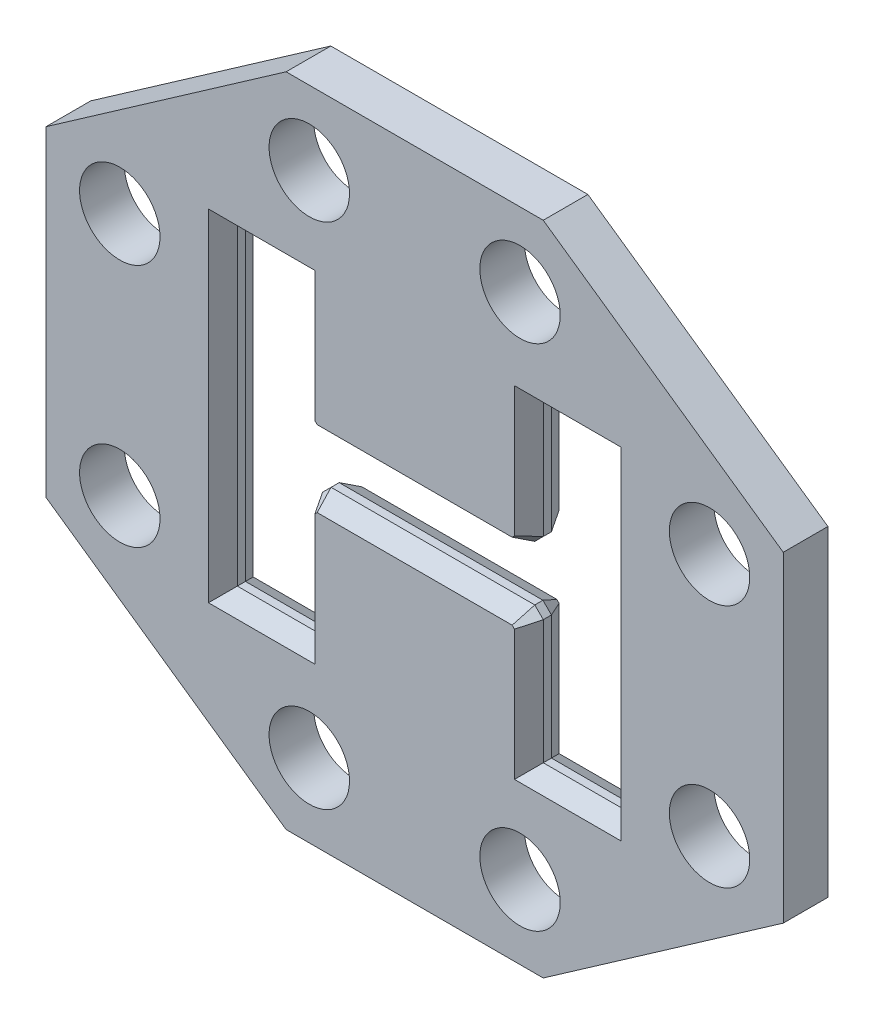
SolidWorks part; units mm, degrees
ref_plane "Front Plane" through (0, 0, 0) normal (1, 0, 0) x (0, 1, 0)
ref_plane "Top Plane" through (0, 0, 0) normal (0, 0, 1) x (0, 1, 0)
ref_plane "Right Plane" through (0, 0, 0) normal (0, 1, 0) x (-1, 0, 0)
sketch "sk W14x730" plane through (0, 0, 0) normal (0, 0, 1) x (0, 1, 0)
  point P0 (0, -284.734)
  point P1 (-38.989, 0)
  line B0 (-227.203, -284.734) -> (-227.203, -160.02)
  line B1 (-227.203, -160.02) -> (-54.229, -160.02)
  line B2 (-38.989, -144.78) -> (-38.989, 144.78)
  line B3 (-54.229, 160.02) -> (-227.203, 160.02)
  line B4 (-227.203, 160.02) -> (-227.203, 284.734)
  line B5 (-227.203, 284.734) -> (227.203, 284.734)
  line B6 (227.203, 284.734) -> (227.203, 160.02)
  line B7 (227.203, 160.02) -> (54.229, 160.02)
  line B8 (38.989, 144.78) -> (38.989, -144.78)
  line B9 (54.229, -160.02) -> (227.203, -160.02)
  line B10 (227.203, -160.02) -> (227.203, -284.734)
  line B11 (227.203, -284.734) -> (-227.203, -284.734)
  arc B12 (-54.229, -160.02) -> (-38.989, -144.78) centre (-54.229, -144.78) ccw
  arc B13 (-38.989, 144.78) -> (-54.229, 160.02) centre (-54.229, 144.78) ccw
  arc B14 (54.229, 160.02) -> (38.989, 144.78) centre (54.229, 144.78) ccw
  arc B15 (38.989, -144.78) -> (54.229, -160.02) centre (54.229, -144.78) ccw
sketch_block_instance "W14x730-113"
sketch_block "W14x730" parameters "D4"=15.24, "D1"=454.406, "D2"=569.468, "D3"=77.978, "D5"=124.714
sketch_block_instance "W14x730-232"
sketch_block_instance "W14x730-233"
sketch_block_instance "W14x730-234"
sketch_block_instance "W14x730-276"
sketch_block_instance "W14x730-277"
sketch_block_instance "W14x730-278"
sketch_block_instance "W14x730-279"
sketch_block_instance "W14x730-280"
sketch_block_instance "W14x730-281"
sketch_block_instance "W14x730-282"
sketch_block_instance "W14x730-283"
sketch_block_instance "W14x730-284"
sketch_block_instance "W14x730-285"
sketch_block_instance "W14x730-286"
sketch_block_instance "W14x730-287"
sketch_block_instance "W14x730-288"
sketch_block_instance "W14x730-289"
sketch_block_instance "W14x730-321"
sketch_block_instance "W14x730-322"
sketch_block_instance "W14x730-323"
sketch_block_instance "W14x730-324"
sketch_block_instance "W14x730-325"
sketch_block_instance "W14x730-326"
sketch_block_instance "W14x730-327"
sketch_block_instance "W14x730-328"
sketch_block_instance "W14x730-329"
sketch_block_instance "W14x730-330"
sketch_block_instance "W14x730-331"
sketch_block_instance "W14x730-332"
sketch_block_instance "W14x730-333"
sketch_block_instance "W14x730-334"
sketch_block_instance "W14x730-335"
sketch_block_instance "W14x730-336"
sketch_block_instance "W14x730-337"
sketch_block_instance "W14x730-338"
sketch_block_instance "W14x730-339"
sketch_block_instance "W14x730-340"
sketch_block_instance "W14x730-341"
sketch_block_instance "W14x730-365"
sketch_block_instance "W14x730-366"
sketch_block_instance "W14x730-367"
sketch_block_instance "W14x730-368"
sketch_block_instance "W14x730-369"
sketch_block_instance "W14x730-370"
sketch_block_instance "W14x730-371"
sketch_block_instance "W14x730-372"
sketch_block_instance "W14x730-373"
sketch_block_instance "W14x730-374"
sketch_block_instance "W14x730-375"
sketch_block_instance "W14x730-376"
sketch_block_instance "W14x730-377"
sketch_block_instance "W14x730-378"
sketch_block_instance "W14x730-379"
sketch_block_instance "W14x730-380"
sketch_block_instance "W14x730-381"
sketch_block_instance "W14x730-382"
sketch_block_instance "W14x730-383"
sketch_block_instance "W14x730-384"
sketch_block_instance "W14x730-385"
sketch_block_instance "W14x730-386"
sketch_block_instance "W14x730-387"
sketch_block_instance "W14x730-388"
sketch_block_instance "W14x730-389"
sketch_block_instance "W14x730-390"
sketch_block_instance "W14x730-391"
sketch_block_instance "W14x730-410"
sketch_block_instance "W14x730-411"
sketch_block_instance "W14x730-412"
sketch_block_instance "W14x730-413"
sketch_block_instance "W14x730-414"
sketch_block_instance "W14x730-415"
sketch_block_instance "W14x730-416"
sketch_block_instance "W14x730-417"
sketch_block_instance "W14x730-418"
sketch_block_instance "W14x730-419"
sketch_block_instance "W14x730-420"
sketch_block_instance "W14x730-421"
sketch_block_instance "W14x730-422"
sketch_block_instance "W14x730-423"
sketch_block_instance "W14x730-424"
sketch_block_instance "W14x730-425"
sketch_block_instance "W14x730-426"
sketch_block_instance "W14x730-427"
sketch_block_instance "W14x730-428"
sketch_block_instance "W14x730-429"
sketch_block_instance "W14x730-430"
sketch_block_instance "W14x730-431"
sketch_block_instance "W14x730-432"
sketch_block_instance "W14x730-433"
sketch_block_instance "W14x730-434"
sketch_block_instance "W14x730-435"
sketch_block_instance "W14x730-436"
sketch_block_instance "W14x730-437"
sketch_block_instance "W14x730-438"
sketch_block_instance "W14x730-439"
sketch_block_instance "W14x730-440"
sketch_block_instance "W14x730-443"
sketch_block_instance "W14x730-454"
sketch_block_instance "W14x730-455"
sketch_block_instance "W14x730-456"
sketch_block_instance "W14x730-457"
sketch_block_instance "W14x730-458"
sketch_block_instance "W14x730-459"
sketch_block_instance "W14x730-460"
sketch_block_instance "W14x730-461"
sketch_block_instance "W14x730-462"
sketch_block_instance "W14x730-463"
sketch_block_instance "W14x730-464"
sketch_block_instance "W14x730-465"
sketch_block_instance "W14x730-466"
sketch_block_instance "W14x730-467"
sketch_block_instance "W14x730-468"
sketch_block_instance "W14x730-469"
sketch_block_instance "W14x730-470"
sketch_block_instance "W14x730-471"
sketch_block_instance "W14x730-472"
sketch_block_instance "W14x730-473"
sketch_block_instance "W14x730-474"
sketch_block_instance "W14x730-475"
sketch_block_instance "W14x730-476"
sketch_block_instance "W14x730-477"
sketch_block_instance "W14x730-478"
sketch_block_instance "W14x730-479"
sketch_block_instance "W14x730-480"
sketch_block_instance "W14x730-481"
sketch_block_instance "W14x730-482"
sketch_block_instance "W14x730-483"
sketch_block_instance "W14x730-484"
sketch_block_instance "W14x730-485"
sketch_block_instance "W14x730-486"
sketch_block_instance "W14x730-487"
sketch_block_instance "W14x730-488"
sketch_block_instance "W14x730-489"
sketch_block_instance "W14x730-490" parameters "D1"=817.9177, "D2"=1027.7361, "D3"=0.4058, "D4"=24.0009, "D5"=0.4058, "D6"=533.4, "D7"=27.3509, "D8"=8374.3758, "D9"=3499.6788, "D10"=18059.4
sketch "sk W14x665" plane through (0, 0, 0) normal (0, 0, 1) x (0, 1, 0)
  point P0 (-224.155, -274.828)
  line B0 (-224.155, -274.828) -> (-224.155, -160.02)
  line B1 (-224.155, -160.02) -> (-51.181, -160.02)
  line B2 (-35.941, -144.78) -> (-35.941, 144.78)
  line B3 (-51.181, 160.02) -> (-224.155, 160.02)
  line B4 (-224.155, 160.02) -> (-224.155, 274.828)
  line B5 (-224.155, 274.828) -> (224.155, 274.828)
  line B6 (224.155, 274.828) -> (224.155, 160.02)
  line B7 (224.155, 160.02) -> (51.181, 160.02)
  line B8 (35.941, 144.78) -> (35.941, -144.78)
  line B9 (51.181, -160.02) -> (224.155, -160.02)
  line B10 (224.155, -160.02) -> (224.155, -274.828)
  line B11 (224.155, -274.828) -> (-224.155, -274.828)
  arc B12 (-51.181, -160.02) -> (-35.941, -144.78) centre (-51.181, -144.78) ccw
  arc B13 (-35.941, 144.78) -> (-51.181, 160.02) centre (-51.181, 144.78) ccw
  arc B14 (51.181, 160.02) -> (35.941, 144.78) centre (51.181, 144.78) ccw
  arc B15 (35.941, -144.78) -> (51.181, -160.02) centre (51.181, -144.78) ccw
sketch_block_instance "W14x665-1"
sketch_block "W14x665" parameters "D4"=15.24, "D1"=448.31, "D2"=549.656, "D3"=71.882, "D5"=114.808, "D6"=6.35
sketch "sk 4\" hex nut Pattern" plane through (0, 0, 0) normal (0, 0, 1) x (0, 1, 0)
  line L7 (419.0803, -173.5887) -> (419.0803, 173.5887)
  line L8 (419.0803, 173.5887) -> (173.5887, 419.0803)
  line L9 (173.5887, 419.0803) -> (-173.5887, 419.0803)
  line L10 (-173.5887, 419.0803) -> (-419.0803, 173.5887)
  line L11 (-419.0803, 173.5887) -> (-419.0803, -173.5887)
  line L12 (-419.0803, -173.5887) -> (-173.5887, -419.0803)
  line L13 (-173.5887, -419.0803) -> (173.5887, -419.0803)
  line L14 (173.5887, -419.0803) -> (419.0803, -173.5887)
  line L29 (54.229, -125.02) -> (262.203, -125.02)
  line L30 (262.203, -125.02) -> (262.203, -319.734)
  line L31 (-262.203, -125.02) -> (-54.229, -125.02)
  line L32 (-262.203, -319.734) -> (-262.203, -125.02)
  line L33 (262.203, -319.734) -> (-262.203, -319.734)
  line L34 (54.229, -125.02) -> (262.203, -125.02)
  line L35 (262.203, -125.02) -> (262.203, -319.734)
  line L36 (-262.203, -125.02) -> (-54.229, -125.02)
  line L37 (-262.203, -319.734) -> (-262.203, -125.02)
  line L38 (262.203, -319.734) -> (-262.203, -319.734)
  line L39 (-419.0803, 173.5887) -> (419.0803, -173.5887)
  line L40 (419.0803, 173.5887) -> (-419.0803, -173.5887)
  line L42 (-466.3243, 523.8553) -> (466.3243, 523.8553)
  line L43 (-466.3243, 523.8553) -> (-466.3243, -523.8553)
  line L44 (262.203, 125.02) -> (54.229, 125.02)
  line L45 (262.203, 319.734) -> (262.203, 125.02)
  line L46 (-262.203, 319.734) -> (262.203, 319.734)
  line L47 (-262.203, 125.02) -> (-262.203, 319.734)
  line L48 (-54.229, 125.02) -> (-262.203, 125.02)
  line L49 (262.203, 125.02) -> (54.229, 125.02)
  line L50 (262.203, 319.734) -> (262.203, 125.02)
  line L51 (-262.203, 319.734) -> (262.203, 319.734)
  line L52 (-262.203, 125.02) -> (-262.203, 319.734)
  line L53 (-54.229, 125.02) -> (-262.203, 125.02)
  line L54 (-466.3243, -523.8553) -> (466.3243, -523.8553)
  line L55 (466.3243, 523.8553) -> (466.3243, -523.8553)
  circle A0 centre (0, 0) radius 419.0803 construction
  line B0 (-128.6781, -496.8678) -> (-83.7675, -419.0803)
  circle B1 centre (-173.5887, -419.0803) radius 77.7875 construction
  circle B2 centre (-173.5887, -419.0803) radius 50.8
  circle B3 centre (-173.5887, -419.0803) radius 89.8213
  circle B4 centre (-173.5887, -419.0803) radius 99.3463
  line B5 (-83.7675, 419.0803) -> (-128.6781, 496.8678)
  line B6 (-128.6781, 496.8678) -> (-218.4994, 496.8678)
  line B7 (-218.4994, 496.8678) -> (-263.41, 419.0803)
  line B8 (-263.41, 419.0803) -> (-218.4994, 341.2928)
  line B9 (-218.4994, 341.2928) -> (-128.6781, 341.2928)
  circle B10 centre (-173.5887, 419.0803) radius 77.7875 construction
  circle B11 centre (-173.5887, 419.0803) radius 50.8
  circle B12 centre (-173.5887, 419.0803) radius 89.8213
  circle B13 centre (-173.5887, 419.0803) radius 99.3463
  line B14 (263.41, 419.0803) -> (218.4994, 496.8678)
  line B15 (218.4994, 496.8678) -> (128.6781, 496.8678)
  line B16 (128.6781, 496.8678) -> (83.7675, 419.0803)
  line B17 (128.6781, 341.2928) -> (218.4994, 341.2928)
  line B18 (218.4994, 341.2928) -> (263.41, 419.0803)
  circle B19 centre (173.5887, 419.0803) radius 50.8
  circle B20 centre (173.5887, 419.0803) radius 89.8213
  circle B21 centre (173.5887, 419.0803) radius 99.3463
  line B22 (263.41, -419.0803) -> (218.4994, -341.2928)
  line B23 (218.4994, -341.2928) -> (128.6781, -341.2928)
  line B24 (83.7675, -419.0803) -> (128.6781, -496.8678)
  line B25 (128.6781, -496.8678) -> (218.4994, -496.8678)
  line B26 (218.4994, -496.8678) -> (263.41, -419.0803)
  circle B27 centre (173.5887, -419.0803) radius 77.7875 construction
  circle B28 centre (173.5887, -419.0803) radius 50.8
  circle B29 centre (173.5887, -419.0803) radius 89.8213
  circle B30 centre (173.5887, -419.0803) radius 99.3463
  line B31 (-271.728, 149.7586) -> (-316.6386, 227.5461)
  line B32 (-316.6386, 227.5461) -> (-406.4599, 227.5461)
  line B33 (-406.4599, 227.5461) -> (-451.3705, 149.7586)
  line B34 (-451.3705, 149.7586) -> (-406.4599, 71.9711)
  line B35 (-406.4599, 71.9711) -> (-316.6386, 71.9711)
  circle B36 centre (-361.5493, 149.7586) radius 77.7875 construction
  circle B37 centre (-361.5493, 149.7586) radius 50.8
  circle B38 centre (-361.5493, 149.7586) radius 89.8213
  circle B39 centre (-361.5493, 149.7586) radius 99.3463
  line B40 (-271.728, -149.7586) -> (-316.6386, -71.9711)
  line B41 (-316.6386, -71.9711) -> (-406.4599, -71.9711)
  line B42 (-406.4599, -71.9711) -> (-451.3705, -149.7586)
  line B43 (-451.3705, -149.7586) -> (-406.4599, -227.5461)
  line B44 (-406.4599, -227.5461) -> (-316.6386, -227.5461)
  line B45 (-316.6386, -227.5461) -> (-271.728, -149.7586)
  circle B46 centre (-361.5493, -149.7586) radius 77.7875 construction
  circle B47 centre (-361.5493, -149.7586) radius 50.8
  circle B48 centre (-361.5493, -149.7586) radius 89.8213
  circle B49 centre (-361.5493, -149.7586) radius 99.3463
  line B50 (451.3705, 149.7586) -> (406.4599, 227.5461)
  line B51 (406.4599, 227.5461) -> (316.6386, 227.5461)
  line B52 (316.6386, 227.5461) -> (271.728, 149.7586)
  line B53 (316.6386, 71.9711) -> (406.4599, 71.9711)
  circle B54 centre (361.5493, 149.7586) radius 77.7875 construction
  circle B55 centre (361.5493, 149.7586) radius 50.8
  circle B56 centre (361.5493, 149.7586) radius 89.8213
  circle B57 centre (361.5493, 149.7586) radius 99.3463
  line B58 (316.6386, -71.9711) -> (271.728, -149.7586)
  line B59 (406.4599, -227.5461) -> (451.3705, -149.7586)
  circle B60 centre (361.5493, -149.7586) radius 77.7875 construction
  circle B61 centre (361.5493, -149.7586) radius 50.8
  circle B62 centre (361.5493, -149.7586) radius 89.8213
  circle B63 centre (361.5493, -149.7586) radius 99.3463
sketch_block_instance "4\" hex nut-1"
sketch_block "4\" hex nut" parameters "D1"=155.575, "D2"=101.6, "D3"=9.525
sketch_block_instance "4\" hex nut-2"
sketch_block_instance "4\" hex nut-3"
sketch_block_instance "4\" hex nut-4"
sketch_block_instance "4\" hex nut-5"
sketch_block_instance "4\" hex nut-6"
sketch_block_instance "4\" hex nut-7"
sketch_block_instance "4\" hex nut-8" parameters "D1"=129.9071, "D2"=77.383, "D3"=138.8929, "D4"=187.7059, "D5"=195.0068, "D6"=231.3326
sketch "Sketch3" plane through (0, 0, 0) normal (0, 0, 1) x (0, 1, 0)
  line L0 (-466.3243, 523.8553) -> (466.3243, 523.8553) construction
  line L1 (466.3243, 523.8553) -> (466.3243, -523.8553) construction
  line L2 (-466.3243, -523.8553) -> (466.3243, -523.8553) construction
  line L3 (-466.3243, 523.8553) -> (-466.3243, -523.8553) construction
  line L4 (228.2342, 523.8553) -> (466.3243, 182.7049)
  line L5 (466.3243, 182.7049) -> (466.3243, -182.7049)
  line L6 (466.3243, -182.7049) -> (228.2342, -523.8553)
  line L7 (228.2342, -523.8553) -> (-228.2342, -523.8553)
  line L8 (-228.2342, -523.8553) -> (-466.3243, -182.7049)
  line L9 (-466.3243, -182.7049) -> (-466.3243, 182.7049)
  line L10 (-466.3243, 182.7049) -> (-228.2342, 523.8553)
  line L11 (-228.2342, 523.8553) -> (228.2342, 523.8553)
  line L93 (-54.229, 156.845) -> (-230.378, 156.845)
  line L94 (-230.378, 156.845) -> (-230.378, 287.909)
  line L95 (230.378, 156.845) -> (54.229, 156.845)
  line L96 (230.378, 287.909) -> (230.378, 156.845)
  line L97 (-230.378, 287.909) -> (230.378, 287.909)
  line L98 (-54.229, 156.845) -> (-230.378, 156.845)
  line L99 (-230.378, 156.845) -> (-230.378, 287.909)
  line L100 (230.378, 156.845) -> (54.229, 156.845)
  line L101 (230.378, 287.909) -> (230.378, 156.845)
  line L102 (-230.378, 287.909) -> (230.378, 287.909)
  line L118 (54.229, -156.845) -> (230.378, -156.845)
  line L119 (230.378, -156.845) -> (230.378, -287.909)
  line L120 (230.378, -287.909) -> (-230.378, -287.909)
  line L121 (-230.378, -287.909) -> (-230.378, -156.845)
  line L122 (-230.378, -156.845) -> (-54.229, -156.845)
  line L123 (54.229, -156.845) -> (230.378, -156.845)
  line L124 (230.378, -156.845) -> (230.378, -287.909)
  line L125 (230.378, -287.909) -> (-230.378, -287.909)
  line L126 (-230.378, -287.909) -> (-230.378, -156.845)
  line L127 (-230.378, -156.845) -> (-54.229, -156.845)
  line L130 (42.164, 144.78) -> (42.164, -144.78)
  line L131 (42.164, 144.78) -> (42.164, -144.78)
  line L132 (-54.229, 156.845) -> (-42.164, 144.78)
  line L133 (-42.164, -144.78) -> (-42.164, 144.78)
  line L134 (-42.164, -144.78) -> (-42.164, 144.78)
  line L135 (42.164, 144.78) -> (54.229, 156.845)
  line L136 (42.164, -144.78) -> (54.229, -156.845)
  line L137 (-54.229, -156.845) -> (-42.164, -144.78)
  circle A0 centre (173.5887, 419.0803) radius 104.775 construction
  circle A1 centre (-173.5887, 419.0803) radius 104.775 construction
  circle A2 centre (-361.5493, 149.7586) radius 104.775 construction
  circle A3 centre (-361.5493, -149.7586) radius 104.775 construction
  circle A4 centre (-173.5887, -419.0803) radius 104.775 construction
  circle A5 centre (173.5887, -419.0803) radius 104.775 construction
  circle A6 centre (361.5493, -149.7586) radius 104.775 construction
  circle A7 centre (361.5493, 149.7586) radius 104.775 construction
  dimension "D1" = 3.175
  dimension "D2" = 3.175
  dimension "D3" = 3.175
  dimension "D4" = 3.175
extrude "Main Plate" add sketch "Sketch3" along normal mid plane 63.5
sketch "Sketch7" plane through (0, 0, 0) normal (0, 0, 1) x (0, 1, 0)
  line L22 (227.33, 278.003) -> (227.33, 156.845)
  line L23 (227.33, 156.845) -> (51.181, 156.845)
  line L24 (-51.181, 156.845) -> (-227.33, 156.845)
  line L25 (-227.33, 156.845) -> (-227.33, 278.003)
  line L26 (-227.33, 278.003) -> (227.33, 278.003)
  line L27 (227.33, 278.003) -> (227.33, 156.845)
  line L28 (227.33, 156.845) -> (51.181, 156.845)
  line L29 (-51.181, 156.845) -> (-227.33, 156.845)
  line L30 (-227.33, 156.845) -> (-227.33, 278.003)
  line L31 (-227.33, 278.003) -> (227.33, 278.003)
  line L42 (-39.116, -144.78) -> (-39.116, 144.78)
  line L43 (-39.116, -144.78) -> (-39.116, 144.78)
  line L44 (-51.181, 156.845) -> (-39.116, 144.78)
  line L45 (227.33, -156.845) -> (227.33, -278.003)
  line L46 (51.181, -156.845) -> (227.33, -156.845)
  line L47 (227.33, -278.003) -> (-227.33, -278.003)
  line L48 (-227.33, -278.003) -> (-227.33, -156.845)
  line L49 (-227.33, -156.845) -> (-51.181, -156.845)
  line L50 (227.33, -156.845) -> (227.33, -278.003)
  line L51 (51.181, -156.845) -> (227.33, -156.845)
  line L52 (227.33, -278.003) -> (-227.33, -278.003)
  line L53 (-227.33, -278.003) -> (-227.33, -156.845)
  line L54 (-227.33, -156.845) -> (-51.181, -156.845)
  line L55 (39.116, 144.78) -> (39.116, -144.78)
  line L56 (39.116, 144.78) -> (39.116, -144.78)
  line L57 (39.116, 144.78) -> (51.181, 156.845)
  line L58 (-39.116, -144.78) -> (-51.181, -156.845)
  line L59 (39.116, -144.78) -> (51.181, -156.845)
  line L61 (-242.3311, 298.7357) -> (246.0967, 298.7357)
  line L62 (-242.3311, 298.7357) -> (-242.3311, -298.6887)
  line L63 (-242.3311, -298.6887) -> (246.0967, -298.6887)
  line L64 (246.0967, 298.7357) -> (246.0967, -298.6887)
  dimension "D1" = 3.175
  dimension "D2" = 3.175
  dimension "D3" = 3.175
  dimension "D4" = 3.175
extrude "W665" add sketch "Sketch7" along normal mid plane 63.5
sketch "Sketch5" plane through (0, 0, 0) normal (0, 0, 1) x (0, 1, 0)
  circle A0 centre (-173.5887, 419.0803) radius 57.15
  circle A1 centre (173.5887, 419.0803) radius 57.15
  circle A2 centre (361.5493, 149.7586) radius 57.15
  circle A3 centre (361.5493, -149.7586) radius 57.15
  circle A4 centre (173.5887, -419.0803) radius 57.15
  circle A5 centre (-173.5887, -419.0803) radius 57.15
  circle A6 centre (-361.5493, -149.7586) radius 57.15
  circle A7 centre (-361.5493, 149.7586) radius 57.15
  dimension "D1" = 114.3
  dimension "D2" = 114.3
  dimension "D3" = 114.3
  dimension "D4" = 114.3
  dimension "D5" = 114.3
  dimension "D6" = 114.3
  dimension "D7" = 114.3
  dimension "D8" = 114.3
extrude "Cut-Extrude1" cut sketch "Sketch5" against normal through all both and the other way through all
chamfer "Chamfer1" distance 15 angle 60 16 edges at (217.424, -227.33, 31.75) (278.003, 0, 31.75) (217.424, 227.33, 31.75) (156.845, 139.2555, 31.75) (150.8125, 45.1485, 31.75) (0, 39.116, 31.75) (-150.8125, 45.1485, 31.75) (-156.845, 139.2555, 31.75) (-217.424, 227.33, 31.75) (-278.003, 0, 31.75) (-217.424, -227.33, 31.75) (-156.845, -139.2555, 31.75) (-150.8125, -45.1485, 31.75) (0, -39.116, 31.75) (150.8125, -45.1485, 31.75) (156.845, -139.2555, 31.75)
chamfer "Chamfer2" distance 15 angle 60 16 edges at (0, -39.116, -31.75) (-156.845, -139.2555, -31.75) (-217.424, -227.33, -31.75) (-278.003, 0, -31.75) (-217.424, 227.33, -31.75) (-156.845, 139.2555, -31.75) (0, 39.116, -31.75) (156.845, 139.2555, -31.75) (217.424, 227.33, -31.75) (278.003, 0, -31.75) (217.424, -227.33, -31.75) (156.845, -139.2555, -31.75) (-150.8125, -45.1485, -31.75) (-150.8125, 45.1485, -31.75) (150.8125, 45.1485, -31.75) (150.8125, -45.1485, -31.75)
